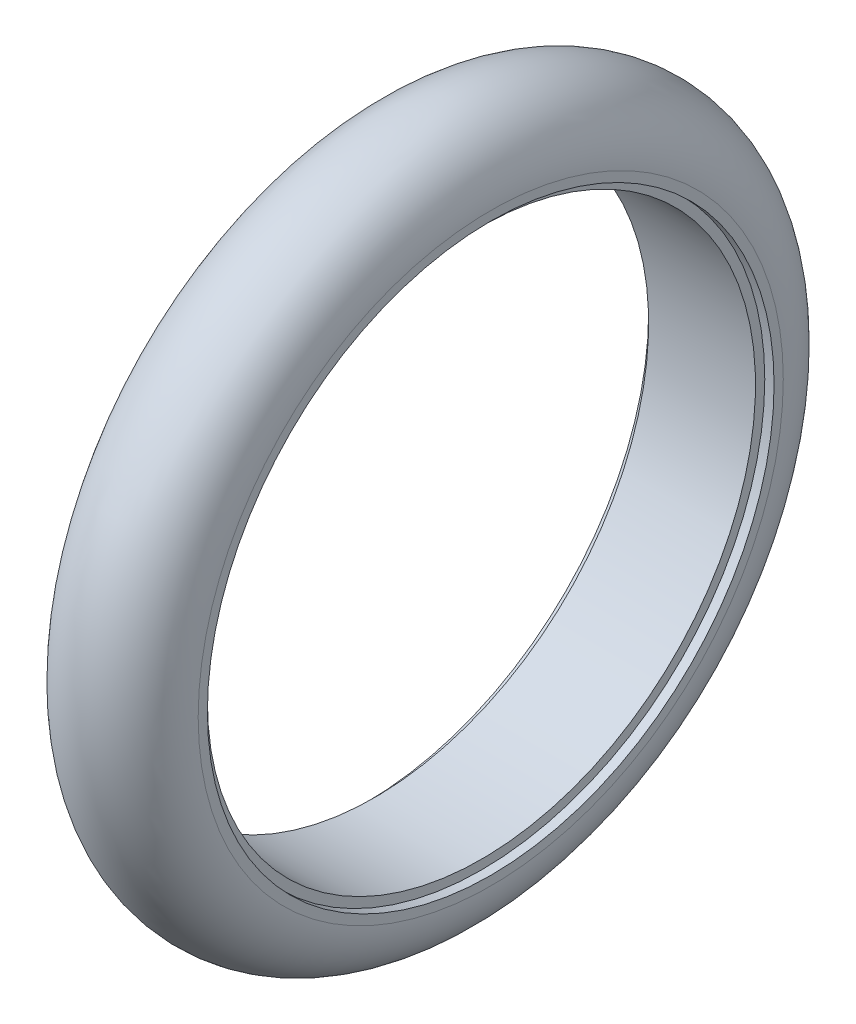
SolidWorks part; units mm, degrees
ref_plane "Front Plane" through (0, 0, 0) normal (0, 0, 1) x (1, 0, 0)
ref_plane "Top Plane" through (0, 0, 0) normal (0, 1, 0) x (1, 0, 0)
ref_plane "Right Plane" through (0, 0, 0) normal (1, 0, 0) x (0, 0, -1)
sketch "Sketch1" plane through (0, 0, 0) normal (0, 0, 1) x (1, 0, 0)
  line L0 (-39.2801, 0) -> (40.5555, 0) construction
  line L1 (0, 0) -> (0, 95.3118) construction
  line L2 (0, 29.5) -> (-5.75, 29.5)
  line L3 (-5.75, 29.5) -> (-5.75, 30.5)
  line L4 (-5.75, 30.5) -> (-6.75, 30.5)
  line L5 (-6.75, 30.5) -> (-6.75, 31.4918)
  line L6 (6.75, 31.4918) -> (6.75, 30.5)
  line L7 (6.75, 30.5) -> (5.75, 30.5)
  line L8 (5.75, 30.5) -> (5.75, 29.5)
  line L9 (5.75, 29.5) -> (0, 29.5)
  arc A0 (-6.75, 31.4918) -> (6.75, 31.4918) centre (0, 31.4918) cw
  dimension "D1" = 13.5
  dimension "D2" = 5.75
  dimension "D3" = 1
  dimension "D4" = 11.5
  dimension "D5" = 1
  dimension "D6" = 61
revolve "Revolve2" add sketch "Sketch1" angle 360 about L0
